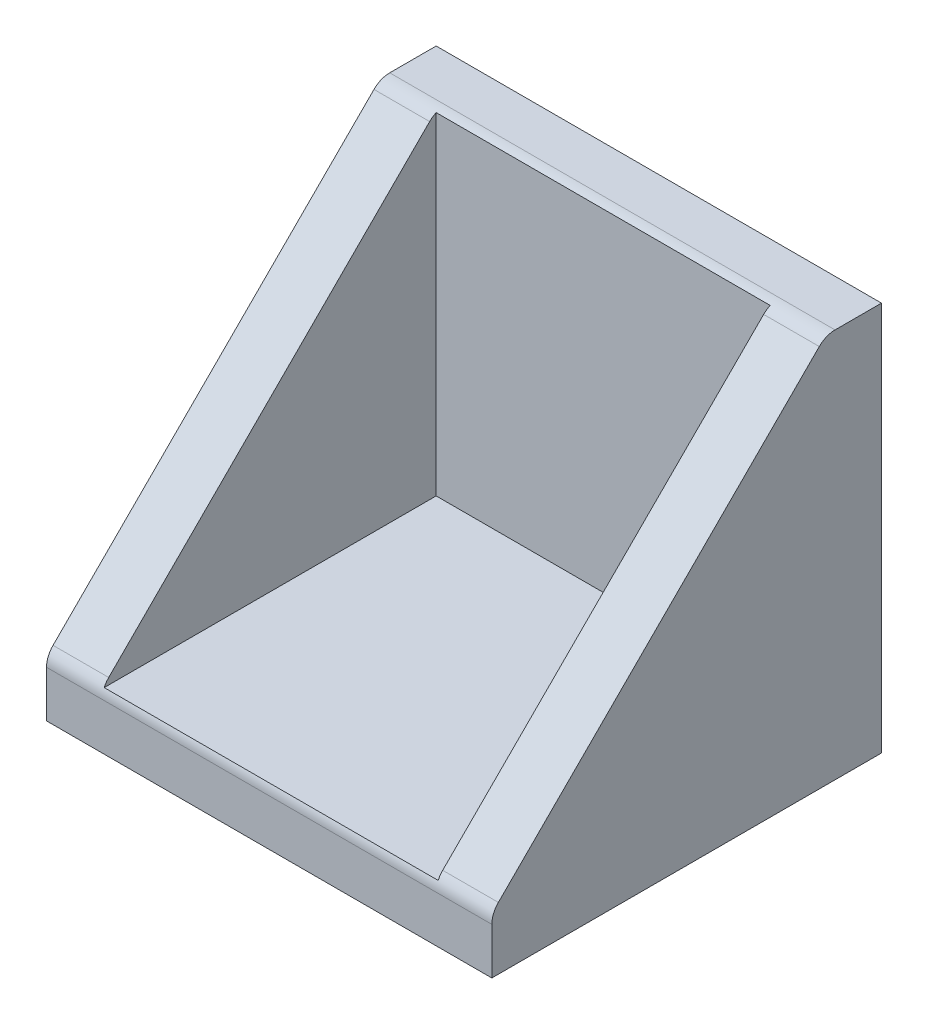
SolidWorks part; units mm, degrees
ref_plane "Front Plane" through (0, 0, 0) normal (0, 0, 1) x (1, 0, 0)
ref_plane "Top Plane" through (0, 0, 0) normal (0, 1, 0) x (1, 0, 0)
ref_plane "Right Plane" through (0, 0, 0) normal (1, 0, 0) x (0, 0, -1)
sketch "Sketch2" plane through (0, 0, 0) normal (0, 1, 0) x (1, 0, 0)
  line L1 (-20, 17.5) -> (20, 17.5)
  line L2 (-20, 17.5) -> (-20, -17.5)
  line L3 (-20, -17.5) -> (20, -17.5)
  line L4 (20, 17.5) -> (20, -17.5)
  line L5 (-20, 17.5) -> (20, -17.5) construction
  line L6 (-20, -17.5) -> (20, 17.5) construction
  point P0 (0, 0)
  dimension "D1" = 40
  dimension "D2" = 35
extrude "Boss-Extrude1" add sketch "Sketch2" along normal blind 5
sketch "Sketch3" plane through (0, 5, 0) normal (0, 1, 0) x (1, 0, 0)
  line L0 (20, -17.5) -> (20, 17.5) construction
  line L1 (-20, 17.5) -> (20, 17.5)
  line L2 (-20, 17.5) -> (-20, 12.5)
  line L3 (-20, 12.5) -> (20, 12.5)
  line L4 (20, 17.5) -> (20, 12.5)
  line L5 (-20, 17.5) -> (20, 12.5) construction
  line L6 (-20, 12.5) -> (20, 17.5) construction
  point P4 (0, 15)
  dimension "D1" = 5
extrude "Boss-Extrude2" add sketch "Sketch3" along normal blind 30
sketch "Sketch4" plane through (20, 0, 0) normal (1, 0, 0) x (0, 0, -1)
  line L0 (12.5, 35) -> (-17.5, 5)
  line L1 (-17.5, 5) -> (12.5, 5)
  line L2 (12.5, 5) -> (12.5, 35)
extrude "Boss-Extrude3" add sketch "Sketch4" against normal blind 5
mirror "Mirror1" about plane through (0, 0, 0) normal (1, 0, 0) of "Boss-Extrude3"
fillet "Fillet3" radius 2 3 edges at (-17.5, 5, 17.5) (17.5, 5, 17.5) (0, 5, 17.5)
fillet "Fillet4" radius 2 3 edges at (-17.5, 35, -12.5) (17.5, 35, -12.5) (0, 35, -12.5)
